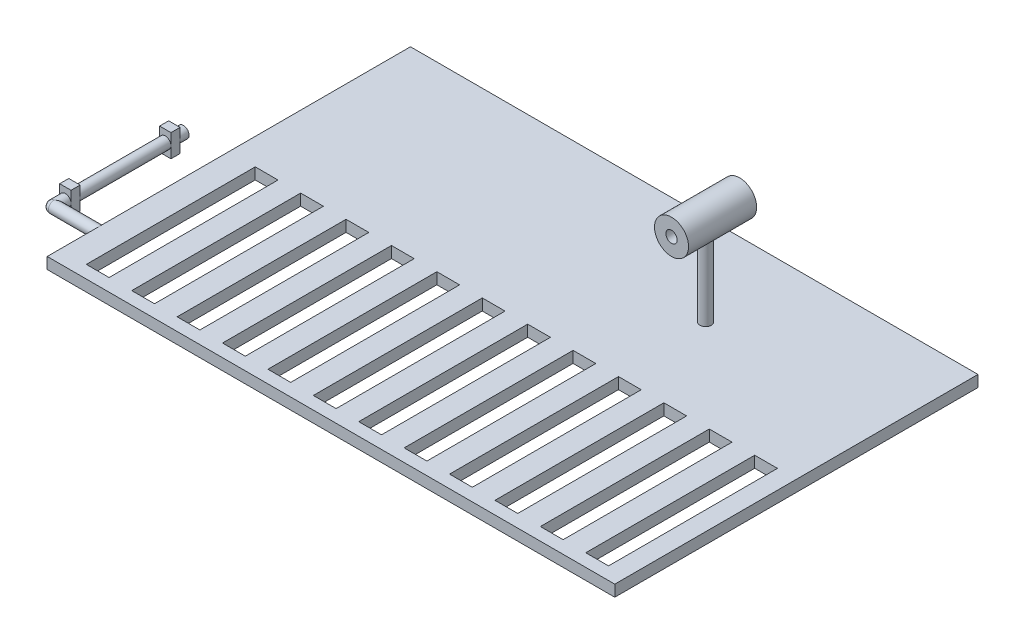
SolidWorks part; units mm, degrees
ref_plane "Face" through (0, 0, 0) normal (0, 0, 1) x (1, 0, 0)
ref_plane "Dessus" through (0, 0, 0) normal (0, 1, 0) x (1, 0, 0)
ref_plane "Droite" through (0, 0, 0) normal (1, 0, 0) x (0, 0, -1)
sketch "Esquisse1" plane through (0, 0, 0) normal (0, 0, 1) x (1, 0, 0)
  circle A0 centre (0, 0) radius 2.5
  dimension "D1" = 5
extrude "Base-Extrusion" add sketch "Esquisse1" along normal blind 4
sketch "Esquisse2" plane through (0, 0, 4) normal (0, 0, 1) x (1, 0, 0)
  line L1 (-2.5, 5) -> (2.5, 5)
  line L2 (-2.5, 5) -> (-2.5, -5)
  line L3 (-2.5, -5) -> (2.5, -5)
  line L4 (2.5, 5) -> (2.5, -5)
  circle A0 centre (0, 0) radius 2.5 construction
  dimension "D1" = 5
  dimension "D2" = 5
extrude "Boss.-Extru.1" add sketch "Esquisse2" along normal blind 4
sketch "Esquisse3" plane through (0, 0, 8) normal (0, 0, 1) x (1, 0, 0)
  arc A0 (2.5, 0) -> (-2.5, 0) centre (0, 0) ccw construction
  arc A1 (2.5, 0) -> (-2.5, 0) centre (0, 0) ccw
  arc A2 (-2.5, 0) -> (2.5, 0) centre (0, 0) ccw construction
  arc A3 (-2.5, 0) -> (2.5, 0) centre (0, 0) ccw
extrude "Boss.-Extru.2" add sketch "Esquisse3" along normal blind 40
sketch "Esquisse4" plane through (0, 0, 48) normal (0, 0, 1) x (1, 0, 0)
  line L3 (2.5, 0) -> (2.5, 5)
  line L4 (2.5, 5) -> (-2.5, 5)
  line L5 (-2.5, 5) -> (-2.5, 0)
  line L6 (2.5, 0) -> (2.5, 5)
  line L7 (2.5, 5) -> (-2.5, 5)
  line L8 (-2.5, 5) -> (-2.5, 0)
  line L9 (-2.5, 0) -> (-2.5, -5)
  line L10 (-2.5, -5) -> (2.5, -5)
  line L11 (2.5, -5) -> (2.5, 0)
  line L12 (-2.5, 0) -> (-2.5, -5)
  line L13 (-2.5, -5) -> (2.5, -5)
  line L14 (2.5, -5) -> (2.5, 0)
  arc A1 (2.5, 0) -> (-2.5, 0) centre (0, 0) ccw
  arc A3 (-2.5, 0) -> (2.5, 0) centre (0, 0) ccw
  dimension "D1" = 0
  dimension "D2" = 0
extrude "Boss.-Extru.3" add sketch "Esquisse4" along normal blind 4
sketch "Esquisse5" plane through (0, 0, 52) normal (0, 0, 1) x (1, 0, 0)
  arc A0 (2.5, 0) -> (-2.5, 0) centre (0, 0) ccw construction
  arc A1 (2.5, 0) -> (-2.5, 0) centre (0, 0) ccw
  arc A2 (-2.5, 0) -> (2.5, 0) centre (0, 0) ccw construction
  arc A3 (-2.5, 0) -> (2.5, 0) centre (0, 0) ccw
extrude "Boss.-Extru.4" add sketch "Esquisse5" along normal blind 5
sketch "Esquisse6" plane through (0, 0, 0) normal (1, 0, 0) x (0, 0, -1)
  line L0 (-4, 0) -> (0, 0) construction
  line L1 (-57, 2.5) -> (-57, -2.5) construction
  circle A0 centre (-57, 0) radius 2.5
  dimension "D1" = 5
extrude "Boss.-Extru.5" add sketch "Esquisse6" along normal blind 20
sketch "Esquisse7" plane through (20, 0, 0) normal (1, 0, 0) x (0, 0, -1)
  line L2 (-80, 2.5) -> (80, 2.5)
  line L3 (-80, 2.5) -> (-80, -2.5)
  line L4 (-80, -2.5) -> (80, -2.5)
  line L5 (80, 2.5) -> (80, -2.5)
  circle A1 centre (-57, 0) radius 2.5 construction
  dimension "D1" = 80
  dimension "D2" = 80
extrude "Boss.-Extru.6" add sketch "Esquisse7" along normal blind 250
sketch "Esquisse8" plane through (0, 2.5, 0) normal (0, 1, 0) x (-1, 0, 0)
  line L0 (-270, -80) -> (-270, 80) construction
  line L1 (-270, -80) -> (-20, -80) construction
  circle A0 centre (-190, -40) radius 2.5
  dimension "D1" = 5
  dimension "D2" = 80
  dimension "D3" = 40
extrude "Boss.-Extru.7" add sketch "Esquisse8" along normal blind 40
ref_plane "Plan1" through (0, 0, -40) normal (0, 0, -1) x (-1, 0, 0)
sketch "Esquisse10" plane through (0, 0, -40) normal (0, 0, -1) x (-1, 0, 0)
  line L0 (-190, 42.5) -> (-190, 2.5) construction
  line L1 (-187.5, 42.5) -> (-192.5, 42.5) construction
  circle A0 centre (-190, 42.5) radius 7.5
  dimension "D1" = 15
extrude "Boss.-Extru.9" add sketch "Esquisse10" along normal blind 15 and the other way blind 15
sketch "Esquisse11" plane through (0, 0, -25) normal (0, 0, 1) x (1, 0, 0)
  circle A0 centre (190, 42.5) radius 2.5
  dimension "D1" = 5
extrude "Enlèv. mat.-Extru.1" cut sketch "Esquisse11" against normal blind 30
sketch "Esquisse12" plane through (0, 2.5, 0) normal (0, 1, 0) x (-1, 0, 0)
  line L0 (-241.6661, 74.4087) -> (-231.6334, 74.4087)
  line L1 (-261.6661, 0) -> (-251.6334, 0)
  line L2 (-261.6661, 0) -> (-261.6661, 74.4087)
  line L3 (-261.6661, 74.4087) -> (-251.6334, 74.4087)
  line L4 (-251.6334, 0) -> (-251.6334, 74.4087)
  line L5 (-231.6334, 0) -> (-231.6334, 74.4087)
  line L6 (-241.6661, 0) -> (-231.6334, 0)
  line L7 (-241.6661, 0) -> (-241.6661, 74.4087)
  line L8 (-221.6661, 74.4087) -> (-211.6334, 74.4087)
  line L9 (-211.6334, 0) -> (-211.6334, 74.4087)
  line L10 (-221.6661, 0) -> (-211.6334, 0)
  line L11 (-221.6661, 0) -> (-221.6661, 74.4087)
  line L12 (-201.6661, 74.4087) -> (-191.6334, 74.4087)
  line L13 (-191.6334, 0) -> (-191.6334, 74.4087)
  line L14 (-201.6661, 0) -> (-191.6334, 0)
  line L15 (-201.6661, 0) -> (-201.6661, 74.4087)
  line L16 (-181.6661, 74.4087) -> (-171.6334, 74.4087)
  line L17 (-171.6334, 0) -> (-171.6334, 74.4087)
  line L18 (-181.6661, 0) -> (-171.6334, 0)
  line L19 (-181.6661, 0) -> (-181.6661, 74.4087)
  line L20 (-161.6661, 74.4087) -> (-151.6334, 74.4087)
  line L21 (-151.6334, 0) -> (-151.6334, 74.4087)
  line L22 (-161.6661, 0) -> (-151.6334, 0)
  line L23 (-161.6661, 0) -> (-161.6661, 74.4087)
  line L24 (-141.6661, 74.4087) -> (-131.6334, 74.4087)
  line L25 (-131.6334, 0) -> (-131.6334, 74.4087)
  line L26 (-141.6661, 0) -> (-131.6334, 0)
  line L27 (-141.6661, 0) -> (-141.6661, 74.4087)
  line L28 (-121.6661, 74.4087) -> (-111.6334, 74.4087)
  line L29 (-111.6334, 0) -> (-111.6334, 74.4087)
  line L30 (-121.6661, 0) -> (-111.6334, 0)
  line L31 (-121.6661, 0) -> (-121.6661, 74.4087)
  line L32 (-101.6661, 74.4087) -> (-91.6334, 74.4087)
  line L33 (-91.6334, 0) -> (-91.6334, 74.4087)
  line L34 (-101.6661, 0) -> (-91.6334, 0)
  line L35 (-101.6661, 0) -> (-101.6661, 74.4087)
  line L36 (-81.6661, 74.4087) -> (-71.6334, 74.4087)
  line L37 (-71.6334, 0) -> (-71.6334, 74.4087)
  line L38 (-81.6661, 0) -> (-71.6334, 0)
  line L39 (-81.6661, 0) -> (-81.6661, 74.4087)
  line L40 (-61.6661, 74.4087) -> (-51.6334, 74.4087)
  line L41 (-51.6334, 0) -> (-51.6334, 74.4087)
  line L42 (-61.6661, 0) -> (-51.6334, 0)
  line L43 (-61.6661, 0) -> (-61.6661, 74.4087)
  line L44 (-41.6661, 74.4087) -> (-31.6334, 74.4087)
  line L45 (-31.6334, 0) -> (-31.6334, 74.4087)
  line L46 (-41.6661, 0) -> (-31.6334, 0)
  line L47 (-41.6661, 0) -> (-41.6661, 74.4087)
extrude "Enlèv. mat.-Extru.2" cut sketch "Esquisse12" against normal blind 30
sketch "Esquisse13" plane through (0, 0, 57) normal (0, 0, 1) x (1, 0, 0)
  line L0 (0, 5.7184) -> (0, -5.1585) construction
  line L1 (0, -2.5) -> (0, 2.5)
  line L2 (0, -2.5) -> (0, 2.5)
  arc A1 (0, 2.5) -> (0, -2.5) centre (0, 0) ccw
  arc A2 (0, 2.5) -> (0, -2.5) centre (0, 0) ccw
  dimension "D1" = 0
revolve "Révolution1" add sketch "Esquisse13" angle 360 about L0
